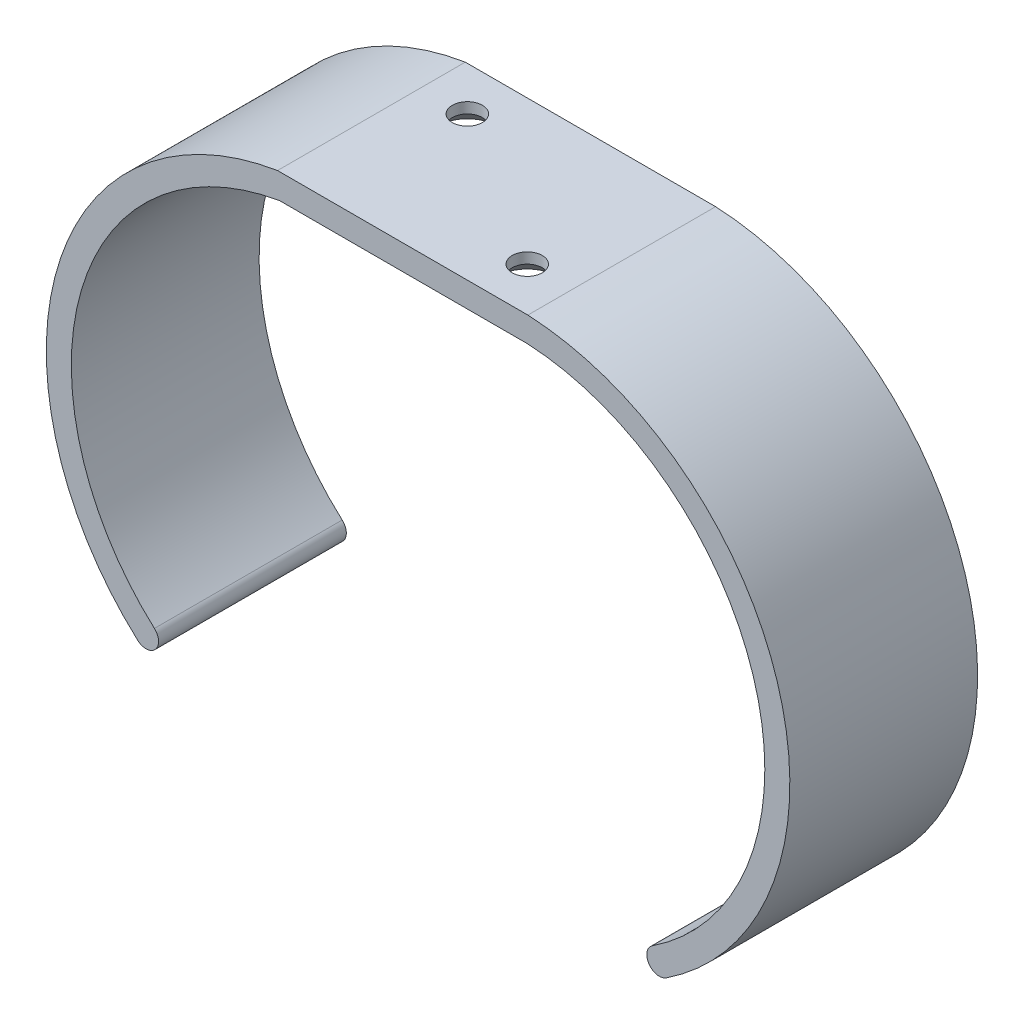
SolidWorks part; units mm, degrees
ref_plane "Plan de face" through (0, 0, 0) normal (0, 0, 1) x (1, 0, 0)
ref_plane "Plan de dessus" through (0, 0, 0) normal (0, 1, 0) x (1, 0, 0)
ref_plane "Plan de droite" through (0, 0, 0) normal (1, 0, 0) x (0, 0, -1)
sketch "Esquisse1" plane through (0, 0, 0) normal (0, 0, 1) x (1, 0, 0)
  line L0 (0, 0) -> (39.5699, 0)
  line L1 (-0.3304, 4) -> (39.6696, 4)
  arc A0 (0, 0) -> (-20, -69.1945) centre (6.7232, -39.4309) ccw
  arc A1 (39.5699, 0) -> (59.5699, -73.328) centre (37.5297, -39.9479) cw
  arc A2 (-0.3304, 4) -> (-22.6723, -72.1709) centre (6.7232, -39.4309) ccw
  arc A3 (39.6696, 4) -> (61.7739, -76.666) centre (37.5297, -39.9479) cw
  arc A4 (-20, -69.1945) -> (-22.6723, -72.1709) centre (-21.3362, -70.6827) cw
  arc A5 (61.7739, -76.666) -> (59.5699, -73.328) centre (60.6719, -74.997) cw
  dimension "D1" = 40
  dimension "D6" = 40
  dimension "D2" = 40
  dimension "D3" = 20
  dimension "D4" = 20
  dimension "D5" = 4
extrude "Boss.-Extru.1" add sketch "Esquisse1" along normal blind 30
sketch "Esquisse3" plane through (0, 0, 0) normal (0, -1, 0) x (1, 0, 0)
  line L0 (0, 30) -> (39.5699, 30) construction
  line L1 (39.5699, 30) -> (39.5699, 0) construction
  line L2 (0, 0) -> (39.5699, 0) construction
  line L3 (0, 30) -> (0, 0) construction
  point P0 (32.5699, 23)
  point P1 (7, 7)
  dimension "D1" = 7
  dimension "D2" = 7
  dimension "D3" = 7
  dimension "D4" = 7
hole_wizard "Fraisage pour vis à tête fraisée M41" positions "Esquisse3D1" profile "Esquisse4" countersink size "M4" standard "ISO"
sketch3d "Esquisse3D1"
  point P0 (32.5699, 0, 23)
  point P3 (7, 0, 7)
sketch "Esquisse4" plane through (32.5699, 0, 23) normal (1, 0, 0) x (0, 0, -1)
  line L0 (0, 0) -> (0, 4)
  line L1 (0, 4) -> (2.4, 4)
  line L2 (2.4, 4) -> (2.4, 2.3)
  line L3 (2.4, 2.3) -> (4.7, 0)
  line L5 (4.7, 0) -> (0, 0)
  line L6 (-2.4, 2.3) -> (-4.7, 0) construction
  line L11 (0, -6.35) -> (0, 107.95) construction
  dimension "Diamètre du perçage jusqu'au prochain" = 4.8
  dimension "Profondeur du perçage jusqu'au prochain" = 4
  dimension "Diamètre du fraisage entrant" = 9.4
  dimension "Angle du fraisage entrant" = 90
